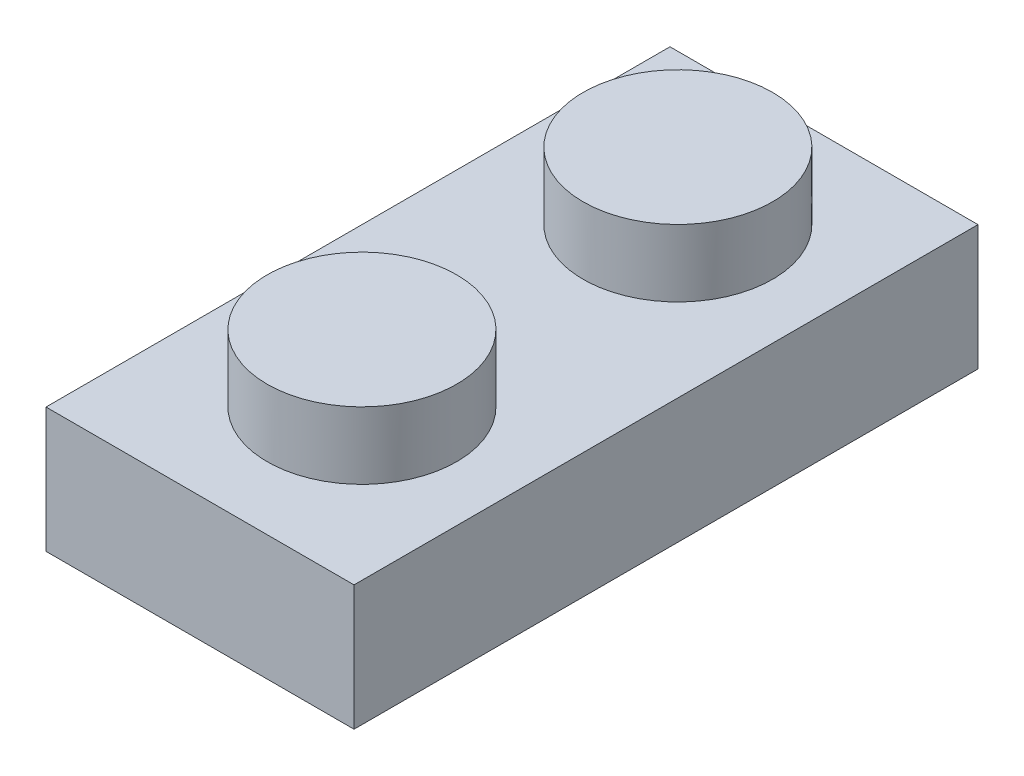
SolidWorks part; units mm, degrees
ref_plane "Front Plane" through (0, 0, 0) normal (0, 0, 1) x (1, 0, 0)
ref_plane "Top Plane" through (0, 0, 0) normal (0, 1, 0) x (1, 0, 0)
ref_plane "Right Plane" through (0, 0, 0) normal (1, 0, 0) x (0, 0, -1)
sketch "Sketch1" plane through (0, 0, 0) normal (0, 1, 0) x (1, 0, 0)
  line L1 (0, 0) -> (7.8, 0)
  line L2 (0, 0) -> (0, 15.8)
  line L3 (0, 15.8) -> (7.8, 15.8)
  line L4 (7.8, 0) -> (7.8, 15.8)
  dimension "D1" = 7.8
  dimension "D2" = 15.8
extrude "Extrude1" add sketch "Sketch1" along normal blind 3.166
sketch "Sketch2" plane through (0, 3.166, 0) normal (0, 1, 0) x (1, 0, 0)
  circle A0 centre (4, 4) radius 2.4
  point P6 (9.3567, 6.1688)
  dimension "D1" = 4.8
extrude "Extrude2" add sketch "Sketch2" along normal blind 1.7
sketch "Sketch3" plane through (0, 0, 0) normal (0, -1, 0) x (1, 0, 0)
  line L0 (7.8, 0) -> (7.8, -15.8) construction
  line L1 (1.45, -9.45) -> (6.35, -9.45)
  line L2 (1.45, -9.45) -> (1.45, -14.35)
  line L3 (1.45, -14.35) -> (6.35, -14.35)
  line L4 (6.35, -9.45) -> (6.35, -14.35)
  line L5 (7.8, -15.8) -> (0, -15.8) construction
  dimension "D1" = 4.9
  dimension "D2" = 1.45
  dimension "D3" = 1.45
extrude "Extrude3" cut sketch "Sketch3" against normal blind 2.5
sketch "Sketch4" plane through (0, 3.166, 0) normal (0, 1, 0) x (1, 0, 0)
  line L0 (3.9, 0) -> (3.9, 16.3566) construction
  line L1 (0, 0) -> (7.8, 0) construction
pattern_linear "LPattern1" count 2 spacing 8 along (0, 0, -1) of "Extrude2"
pattern_linear "LPattern2" count 2 spacing 8 along (0, 0, 1) of "Extrude3"
